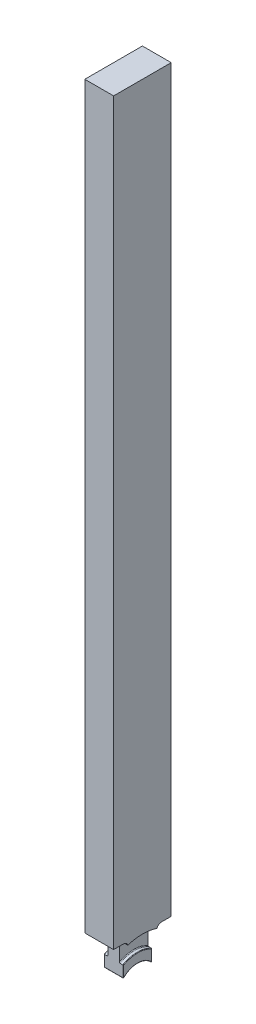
SolidWorks part; units mm, degrees
ref_plane "Front Plane" through (0, 0, 0) normal (0, 0, 1) x (1, 0, 0)
ref_plane "Top Plane" through (0, 0, 0) normal (0, 1, 0) x (1, 0, 0)
ref_plane "Right Plane" through (0, 0, 0) normal (1, 0, 0) x (0, 0, -1)
sketch "Sketch1" plane through (0, 0, 0) normal (1, 0, 0) x (0, 0, -1)
  line L0 (-15, 410) -> (-15, 0)
  line L1 (0, 249.2329) -> (0, 0) construction
  line L2 (15, 410) -> (15, 0)
  line L3 (-15, 410) -> (15, 410)
  line L6 (-15, 0) -> (15, 0)
  arc A0 (-10, 0) -> (10, 0) centre (0, 0) cw construction
  dimension "R" = 10
  dimension "L" = 400
  dimension "T" = 30
extrude "Boss-Extrude1" add sketch "Sketch1" along normal mid plane 15
sketch "Sketch8" plane through (0, 0, 0) normal (1, 0, 0) x (0, 0, -1)
  circle A0 centre (0, 0) radius 10
  arc A1 (10, 0) -> (-10, 0) centre (0, 0) ccw construction
extrude "Cut-Extrude4" cut sketch "Sketch8" against normal through all both and the other way through all
sketch "Sketch2" plane through (0, 0, 0) normal (0, 0, 1) x (1, 0, 0)
  line L0 (7.5, 15) -> (3, 15)
  line L1 (7.5, 410) -> (7.5, 0) construction
  line L2 (3, 15) -> (3, 24.5)
  line L3 (3, 24.5) -> (7.5, 24.5)
  line L4 (7.5, 24.5) -> (7.5, 15)
  line L5 (0, 29.9173) -> (0, 0) construction
  line L6 (-7.5, 24.5) -> (-7.5, 15)
  line L7 (-3, 24.5) -> (-7.5, 24.5)
  line L8 (-3, 15) -> (-3, 24.5)
  line L9 (-7.5, 15) -> (-3, 15)
  line L10 (-8.8482, 0) -> (24.5305, 0) construction
  dimension "D1" = 6
  dimension "D2" = 24.5
  dimension "D3" = 15
revolve "Cut-Revolve1" cut sketch "Sketch2" angle 360 about L10
sketch "Sketch6" plane through (0, 0, 0) normal (1, 0, 0) x (0, 0, -1)
  line L0 (0, 19.903) -> (0, 0) construction
  line L1 (7.5, 0) -> (26.55, 0)
  line L2 (7.5, 0) -> (7.5, 22.6124)
  line L3 (9.8876, 25) -> (26.55, 25)
  line L4 (26.55, 0) -> (26.55, 25)
  line L9 (-7.5, 0) -> (-26.55, 0)
  line L10 (-26.55, 0) -> (-26.55, 25)
  line L11 (-9.8876, 25) -> (-26.55, 25)
  line L12 (-7.5, 0) -> (-7.5, 22.6124)
  arc A0 (7.5, 22.6124) -> (9.8876, 25) centre (9.8876, 22.6124) cw
  arc A1 (-7.5, 22.6124) -> (-9.8876, 25) centre (-9.8876, 22.6124) ccw
  dimension "D3" = 2.3876
  dimension "D1" = 25
  dimension "MT" = 15
  dimension "D2" = 19.05
extrude "Cut-Extrude2" cut sketch "Sketch6" against normal through all both and the other way through all
sketch "Sketch7" plane through (0, 0, 0) normal (0, 0, 1) x (1, 0, 0)
  line L6 (-7.5, 15) -> (-5, 15)
  line L8 (-7.5, 15) -> (-7.5, 0)
  line L9 (-7.5, 0) -> (-5, 0)
  line L10 (-5, 15) -> (-5, 0)
  line L11 (0, 16.5651) -> (0, 5.9342) construction
  line L12 (5, 15) -> (5, 0)
  line L13 (7.5, 0) -> (5, 0)
  line L14 (7.5, 15) -> (7.5, 0)
  line L15 (7.5, 15) -> (5, 15)
  dimension "MW" = 10
extrude "Cut-Extrude3" cut sketch "Sketch7" against normal through all both and the other way through all
fillet "Fillet1" radius 0.762 2 edges at (-3, 24.5, 0) (3, 24.5, 0)
fillet "Fillet2" radius 0.381 2 edges at (-3, 15, 0) (3, 15, 0)
fillet "Fillet3" radius 0.254 10 edges at (5, 9.8024, -7.5) (5, 9.8024, 7.5) (5, 15, 0) (-5, 9.8024, 7.5) (-5, 9.8024, -7.5) (-5, 15, 0) (5, 10, 0) (-5, 10, 0) (0, 6.6144, -7.5) (0, 6.6144, 7.5)
